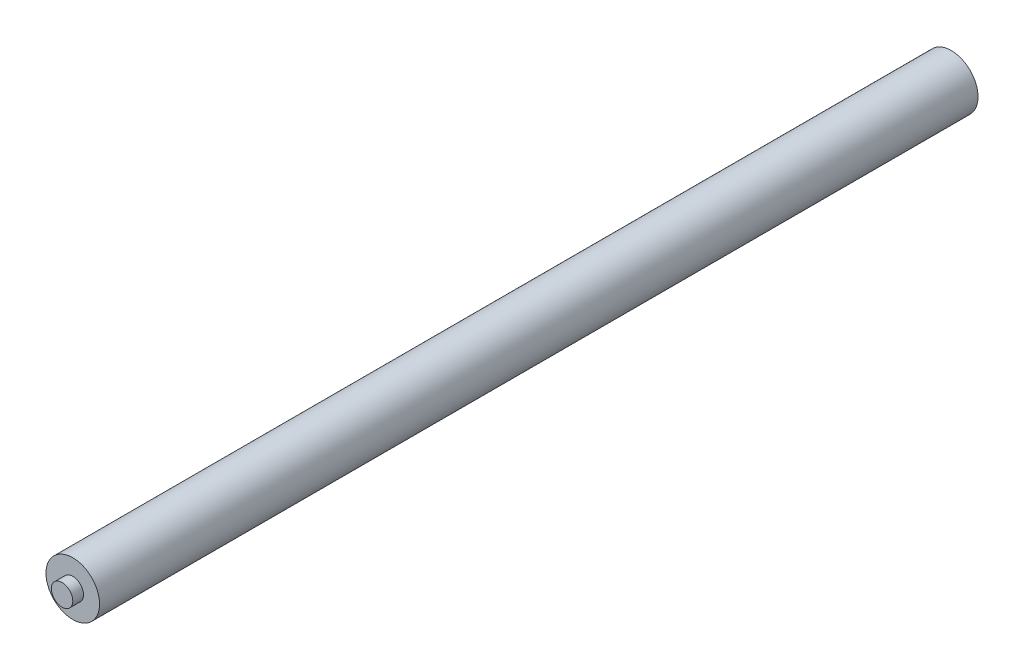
SolidWorks part; units mm, degrees
ref_plane "Front Plane" through (0, 0, 0) normal (0, 0, 1) x (1, 0, 0)
ref_plane "Top Plane" through (0, 0, 0) normal (0, 1, 0) x (1, 0, 0)
ref_plane "Right Plane" through (0, 0, 0) normal (1, 0, 0) x (0, 0, -1)
sketch "Sketch1" plane through (0, 0, 0) normal (0, 0, 1) x (1, 0, 0)
  circle A0 centre (0, 0) radius 12.5
  dimension "D1" = 25
extrude "Boss-Extrude1" add sketch "Sketch1" along normal blind 410
sketch "Sketch2" plane through (0, 0, 410) normal (0, 0, 1) x (1, 0, 0)
  circle A0 centre (0, 0) radius 5
  dimension "D1" = 10
extrude "Boss-Extrude2" add sketch "Sketch2" along normal blind 5
